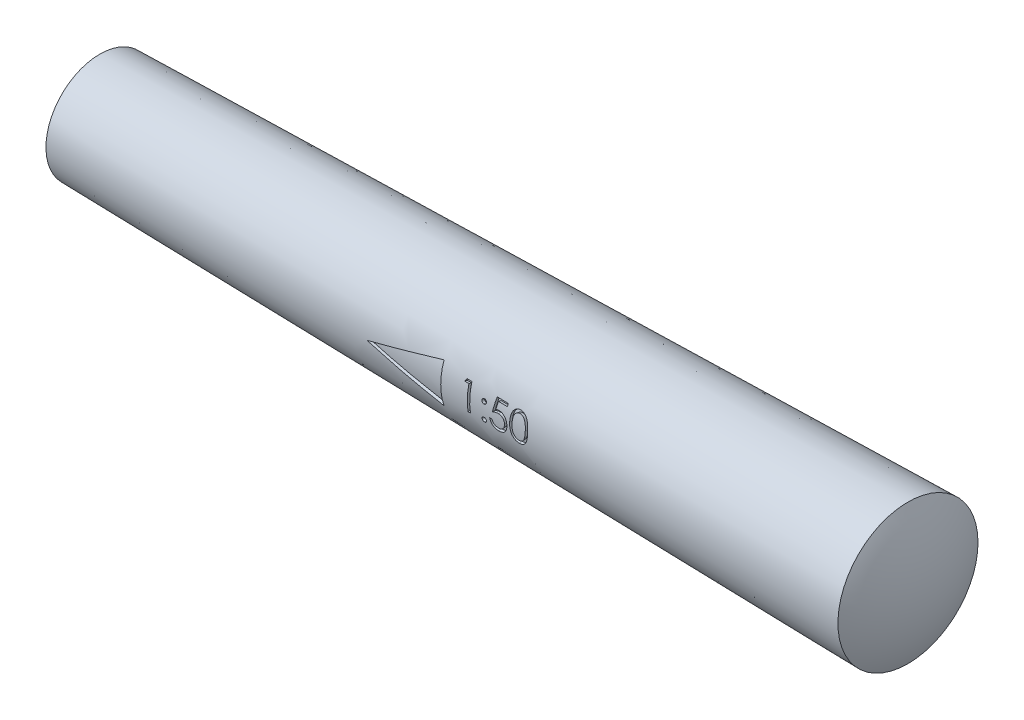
SolidWorks part; units mm, degrees
ref_plane "Front Plane" through (0, 0, 0) normal (0, 0, 1) x (1, 0, 0)
ref_plane "Top Plane" through (0, 0, 0) normal (0, 1, 0) x (1, 0, 0)
ref_plane "Right Plane" through (0, 0, 0) normal (1, 0, 0) x (0, 0, -1)
sketch "Sketch1" plane through (0, 0, 0) normal (1, 0, 0) x (0, 0, -1)
  circle A0 centre (0, 0) radius 2
  dimension "D1" = 4
extrude "Extrude1" add sketch "Sketch1" along normal mid plane 30
draft "Draft1" type of draft neutral plane draft angle 1.146 faces to draft 1 parameters "D1"=1.146
sketch "Sketch2" plane through (0, 0, 0) normal (0, 0, 1) x (1, 0, 0)
  line L0 (-15, 0) -> (-15, 2)
  line L1 (-15, 2) -> (-15, -2) construction
  line L2 (-15, 0) -> (-15.6, 0)
  line L3 (-15.6, 0) -> (-15.6, -2.3) construction
  line L4 (15, 0) -> (15, 2.6)
  line L5 (15, -2.6) -> (15, 2.6) construction
  line L6 (15, 0) -> (15.6, 0)
  line L7 (15.6, 0) -> (15.6, -2.3) construction
  line L8 (-15, -2) -> (15, -2.6) construction
  arc A0 (-15.6, 0) -> (-15, 2) centre (-11.9667, 0) cw
  arc A1 (15.6, 0) -> (15, 2.6) centre (9.6666, 0) ccw
  point P14 (0, -2.3)
revolve "Revolve1" add sketch "Sketch2" angle 360 about L2
sketch "Sketch5" plane through (0, 0, 0) normal (0, 0, 1) x (1, 0, 0)
  line L0 (0, 2.3) -> (0, -2.3) construction
  line L1 (15, 2.6) -> (-15, 2) construction
  line L2 (-15, -2) -> (15, -2.6) construction
ref_plane "Plane2" through (0, 0, 0) normal (-0.02, 0, 0.9998) x (0.9998, 0, 0.02)
sketch "Sketch6" plane through (0, 0, 0) normal (-0.02, 0, 0.9998) x (0.9998, 0, 0.02)
  line L0 (0, 0) -> (0, 0.75)
  line L1 (0, 2.3) -> (0, -2.3) construction
  line L2 (0, 0.75) -> (-2.799, 0)
  line L3 (-2.799, 0) -> (0, -0.75)
  line L4 (0, -0.75) -> (0, 0)
  line L5 (0, -0.375) -> (4, -0.375) construction
  text T0 "1:50" font "Century Gothic" height 1
  dimension "D1" = 1.5
  dimension "D2" = 30
  dimension "D3" = 4
wrap "Wrap2" sketch "Sketch6" wrap type deboss source sketch "Sketch6" thickness 0.1 parameters "D1"=0.1
equation "\"D2@Sketch2\" = \"D1@Sketch2\""
